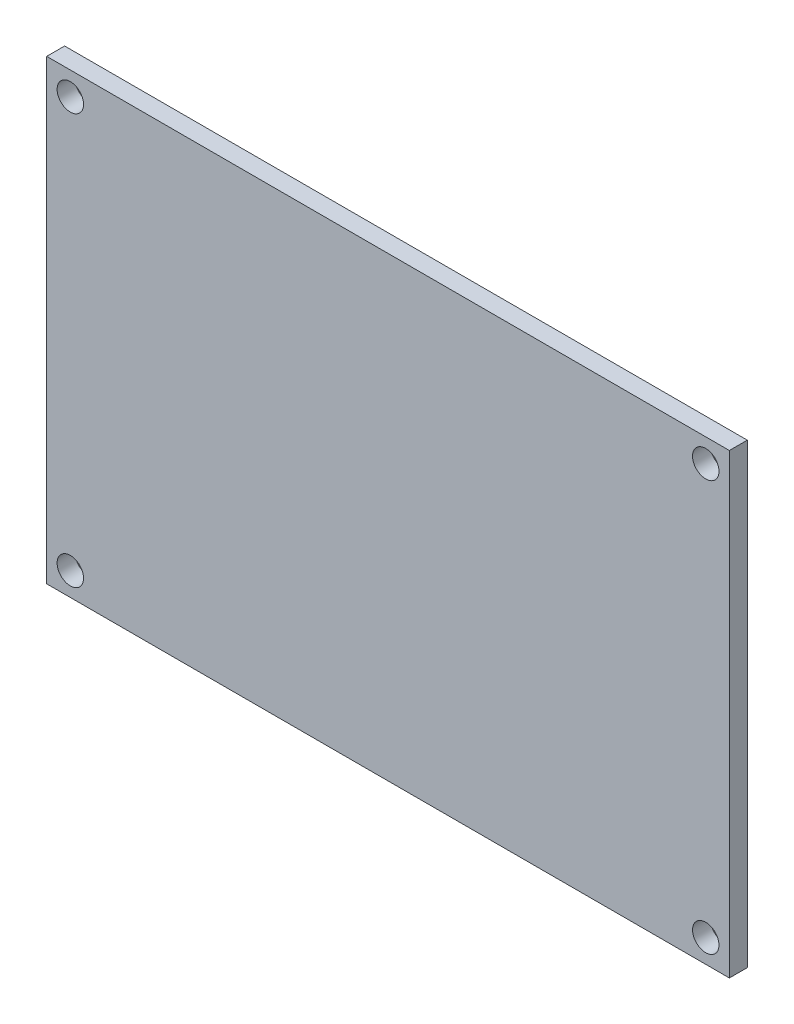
SolidWorks part; units mm, degrees
ref_plane "Front Plane" through (0, 0, 0) normal (0, 0, 1) x (1, 0, 0)
ref_plane "Top Plane" through (0, 0, 0) normal (0, 1, 0) x (1, 0, 0)
ref_plane "Right Plane" through (0, 0, 0) normal (1, 0, 0) x (0, 0, -1)
sketch "Sketch1" plane through (0, 0, 0) normal (0, 0, 1) x (1, 0, 0)
  line L0 (30.0037, 20.0787) -> (-30.0037, -20.0787) construction
  line L1 (-30.0038, 20.0787) -> (30.0037, 20.0787)
  line L2 (-30.0038, 20.0787) -> (-30.0037, -20.0787)
  line L3 (-30.0037, -20.0787) -> (30.0038, -20.0787)
  line L4 (30.0037, 20.0787) -> (30.0038, -20.0787)
  line L5 (-27.9273, 18.034) -> (27.9273, -18.034) construction
  line L6 (-27.9273, 18.034) -> (27.9273, 18.034) construction
  line L7 (-27.9273, 18.034) -> (-27.9273, -18.034) construction
  line L8 (-27.9273, -18.034) -> (27.9273, -18.034) construction
  line L9 (27.9273, 18.034) -> (27.9273, -18.034) construction
  circle A0 centre (27.9273, 18.034) radius 1.162
  circle A1 centre (27.9273, -18.034) radius 1.1621
  circle A2 centre (-27.9273, -18.034) radius 1.162
  circle A3 centre (-27.9273, 18.034) radius 1.162
  point P4 (0, 0)
  point P5 (0, 0)
  point P10 (-29.0894, 18.034)
  point P14 (-27.9273, 19.196)
  dimension "D4" = 2.3241
  dimension "D1" = 60.0075
  dimension "D2" = 40.1574
  dimension "D3" = 55.8546
  dimension "D5" = 36.068
extrude "Boss-Extrude1" add sketch "Sketch1" along normal blind 1.5748
